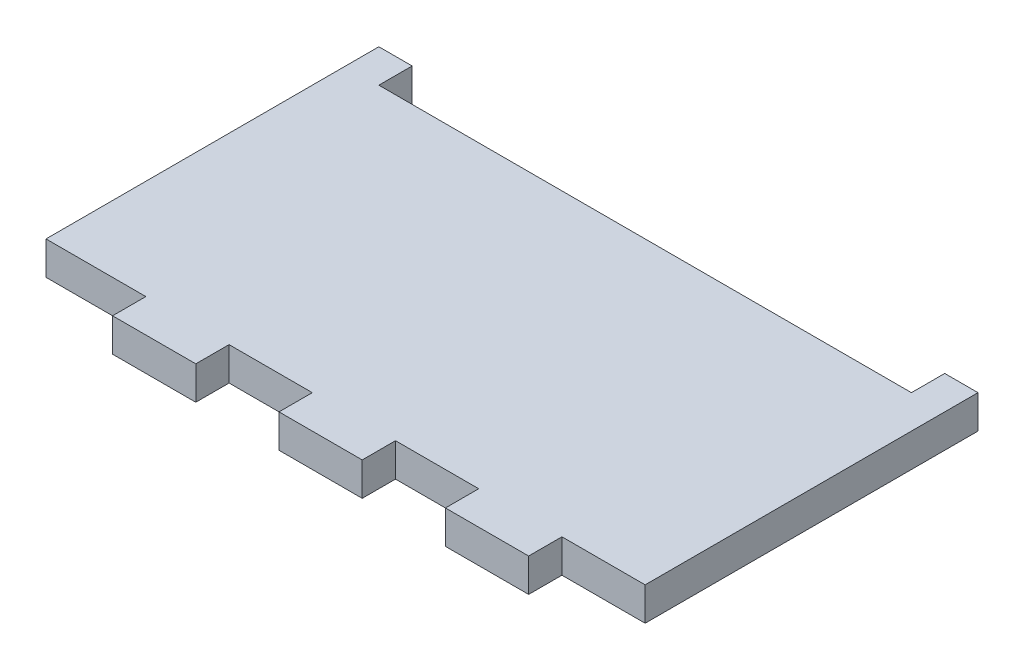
SolidWorks part; units mm, degrees
ref_plane "Front Plane" through (0, 0, 0) normal (0, 0, 1) x (1, 0, 0)
ref_plane "Top Plane" through (0, 0, 0) normal (0, 1, 0) x (1, 0, 0)
ref_plane "Right Plane" through (0, 0, 0) normal (1, 0, 0) x (0, 0, -1)
sketch "Sketch1" plane through (0, 0, 0) normal (0, 0, 1) x (1, 0, 0)
  line L0 (-18, -5.5) -> (-18, 5.5) construction
  line L1 (18, -7.5) -> (-18, -7.5)
  line L2 (18, -7.5) -> (18, -5.5)
  line L3 (18, -5.5) -> (-18, -5.5)
  line L4 (-18, -7.5) -> (-18, -5.5)
extrude "Boss-Extrude1" add sketch "Sketch1" along normal up to surface (18 mm away)
sketch "Sketch2" plane through (0, 0, 0) normal (0, 0, -1) x (-1, 0, 0)
  line L0 (18, -7.5) -> (-18, -7.5) construction
  line L1 (18, -5.5) -> (16, -5.5)
  line L2 (18, -5.5) -> (18, -7.5)
  line L3 (18, -7.5) -> (16, -7.5)
  line L4 (16, -5.5) -> (16, -7.5)
extrude "Boss-Extrude2" add sketch "Sketch2" along normal blind 2
mirror "Mirror1" about plane through (0, 0, 0) normal (1, 0, 0) of "Boss-Extrude1", "Boss-Extrude2"
sketch "Sketch3" plane through (0, 0, 18) normal (0, 0, 1) x (1, 0, 0)
  line L4 (18, -7.5) -> (-18, -7.5) construction
  line L5 (13, -7.5) -> (8, -7.5)
  line L6 (13, -7.5) -> (13, -5.5)
  line L7 (13, -5.5) -> (8, -5.5)
  line L16 (8, -7.5) -> (8, -5.5)
  line L18 (-18, -5.5) -> (18, -5.5) construction
  line L21 (18, -5.5) -> (18, -7.5) construction
  dimension "D1" = 5
  dimension "D2" = 5
extrude "Boss-Extrude3" add sketch "Sketch3" along normal blind 2
pattern_linear "LPattern1" count 3 spacing 10 along (-1, 0, 0) of "Boss-Extrude3"
equation "\"anch\" = 2"
equation "\"alt\" = 100"
equation "\"pilanch\" = 100"
equation "\"pilalt\" = 250"
equation "\"bodyHeigh\" = 60"
equation "\"dorsalFinHeigh\" = 400"
equation "\"D1@Sketch1\"=\"anch\""
equation "\"D1@Sketch2\"=\"anch\""
equation "\"D1@Boss-Extrude2\"=\"anch\""
equation "\"D1@Boss-Extrude3\"=\"anch\""
